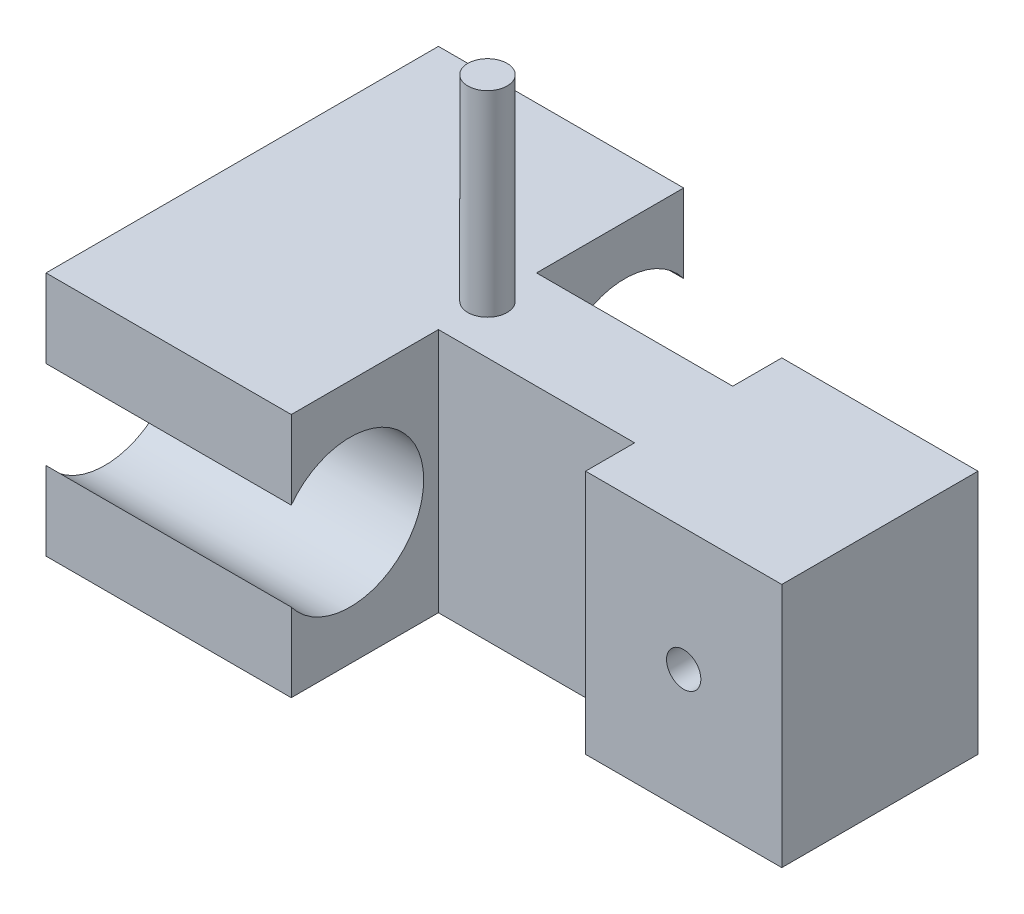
SolidWorks part; units mm, degrees
ref_plane "Front Plane" through (0, 0, 0) normal (0, 0, 1) x (1, 0, 0)
ref_plane "Top Plane" through (0, 0, 0) normal (0, 1, 0) x (1, 0, 0)
ref_plane "Right Plane" through (0, 0, 0) normal (1, 0, 0) x (0, 0, -1)
sketch "Sketch1" plane through (0, 0, 0) normal (0, 1, 0) x (1, 0, 0)
  line L0 (0, 0) -> (165.1, 0)
  line L1 (0, 0) -> (0, 50.8)
  line L2 (0, 50.8) -> (63.5, 50.8)
  line L3 (63.5, 50.8) -> (63.5, 12.7)
  line L4 (63.5, 12.7) -> (114.3, 12.7)
  line L5 (114.3, 12.7) -> (114.3, 25.4)
  line L6 (114.3, 25.4) -> (165.1, 25.4)
  line L7 (165.1, 25.4) -> (165.1, 0)
  dimension "D1" = 50.8
  dimension "D2" = 12.7
  dimension "D3" = 25.4
  dimension "D4" = 63.5
  dimension "D5" = 50.8
  dimension "D6" = 50.8
extrude "Boss-Extrude1" add sketch "Sketch1" along normal blind 63.5
mirror "Mirror1" about plane through (0, 63.5, 0) normal (0, 0, -1) of "Boss-Extrude1"
sketch "Sketch2" plane through (0, 0, 0) normal (-1, 0, 0) x (0, 0, 1)
  line L0 (-50.8, 31.75) -> (50.8, 31.75) construction
  line L1 (-50.8, 63.5) -> (-50.8, 0) construction
  line L2 (50.8, 63.5) -> (50.8, 0) construction
  line L3 (0, 31.75) -> (0, 0) construction
  line L4 (-50.8, 0) -> (50.8, 0) construction
  circle A0 centre (-35.56, 31.75) radius 19.05
  circle A1 centre (35.56, 31.75) radius 19.05
  dimension "D1" = 38.1
  dimension "D2" = 15.24
extrude "Cut-Extrude1" cut sketch "Sketch2" against normal up to surface (63.5 mm away)
sketch "Sketch3" plane through (0, 0, -25.4) normal (0, 0, -1) x (-1, 0, 0)
  line L0 (-165.1, 31.75) -> (-114.3, 31.75) construction
  line L1 (-165.1, 63.5) -> (-165.1, 0) construction
  line L2 (-114.3, 63.5) -> (-114.3, 0) construction
  circle A0 centre (-139.7, 31.75) radius 4.445
  dimension "D1" = 8.89
extrude "Cut-Extrude2" cut sketch "Sketch3" against normal up to surface (50.8 mm away)
sketch "Sketch4" plane through (0, 63.5, 0) normal (0, 1, 0) x (1, 0, 0)
  circle A0 centre (63.5, 0) radius 5.08
  dimension "D1" = 10.16
extrude "Boss-Extrude2" add sketch "Sketch4" along normal blind 50.8
